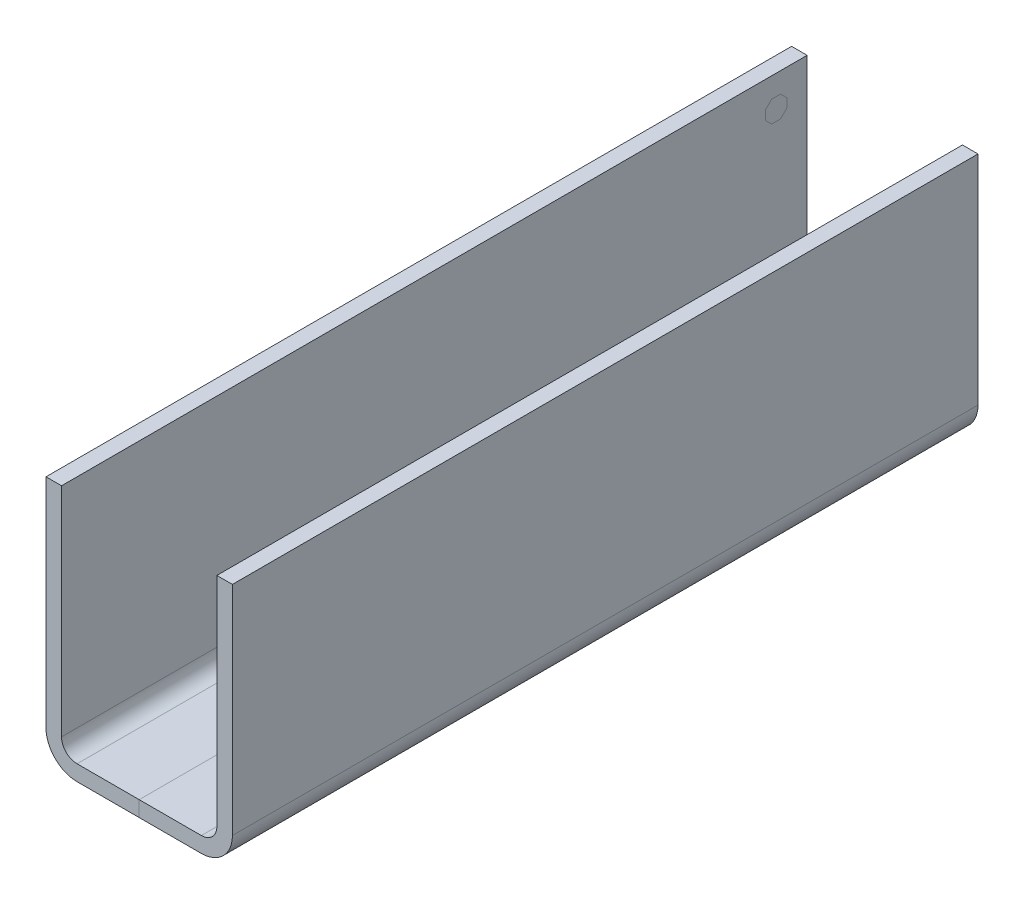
SolidWorks part; units mm, degrees
ref_plane "Front Plane" through (0, 0, 0) normal (0, 0, 1) x (1, 0, 0)
ref_plane "Top Plane" through (0, 0, 0) normal (0, 1, 0) x (1, 0, 0)
ref_plane "Right Plane" through (0, 0, 0) normal (1, 0, 0) x (0, 0, -1)
sketch "Sketch1" plane through (0, 0, 0) normal (0, 0, 1) x (1, 0, 0)
  line L1 (-50.8, 0) -> (50.8, 0)
  line L2 (-76.2, 25.4) -> (-76.2, 203.2)
  line L4 (76.2, 25.4) -> (76.2, 203.2)
  arc A0 (-50.8, 0) -> (-76.2, 25.4) centre (-50.8, 25.4) cw
  arc A1 (50.8, 0) -> (76.2, 25.4) centre (50.8, 25.4) ccw
  point P7 (-76.2, 0)
  point P10 (76.2, 0)
  dimension "D3" = 25.4
  dimension "D1" = 152.4
  dimension "D2" = 203.2
extrude "Extrude-Thin1" add sketch "Sketch1" along normal mid plane 609.6 thin
sketch "Sketch2" plane through (76.2, 0, 0) normal (1, 0, 0) x (0, 0, -1)
  line L0 (304.8, 203.2) -> (304.8, 25.4) construction
  line L1 (-304.8, 203.2) -> (304.8, 203.2) construction
  line L3 (283.0451, 186.6) -> (275.7549, 186.6)
  line L4 (275.7549, 186.6) -> (270.6, 181.4451)
  line L5 (270.6, 181.4451) -> (270.6, 174.1549)
  line L6 (270.6, 174.1549) -> (275.7549, 169)
  line L7 (275.7549, 169) -> (283.0451, 169)
  line L8 (283.0451, 169) -> (288.2, 174.1549)
  line L9 (288.2, 174.1549) -> (288.2, 181.4451)
  line L10 (288.2, 181.4451) -> (283.0451, 186.6)
  circle A0 centre (279.4, 177.8) radius 9.525 construction
  circle A1 centre (279.4, 177.8) radius 9.525 construction
  dimension "D1" = 19.05
  dimension "D2" = 25.4
  dimension "D3" = 25.4
sketch "Sketch3" plane through (-76.2, 0, 0) normal (-1, 0, 0) x (0, 0, 1)
  line L1 (-262.5718, 171.3815) -> (-204.7515, 171.3815)
  line L2 (-262.5718, 171.3815) -> (-262.5718, 48.5543)
  line L3 (-262.5718, 48.5543) -> (-204.7515, 48.5543)
  line L4 (-204.7515, 171.3815) -> (-204.7515, 48.5543)
sketch "Sketch4" plane through (0, 12.7, 0) normal (0, 1, 0) x (1, 0, 0)
  line L0 (0, -304.8) -> (0, 304.8)
  line L1 (50.8, -304.8) -> (-50.8, -304.8) construction
  line L2 (50.8, 304.8) -> (-50.8, 304.8) construction
split "Split1" trim tools "Sketch4" bodies to split 101 resulting bodies 102 103
